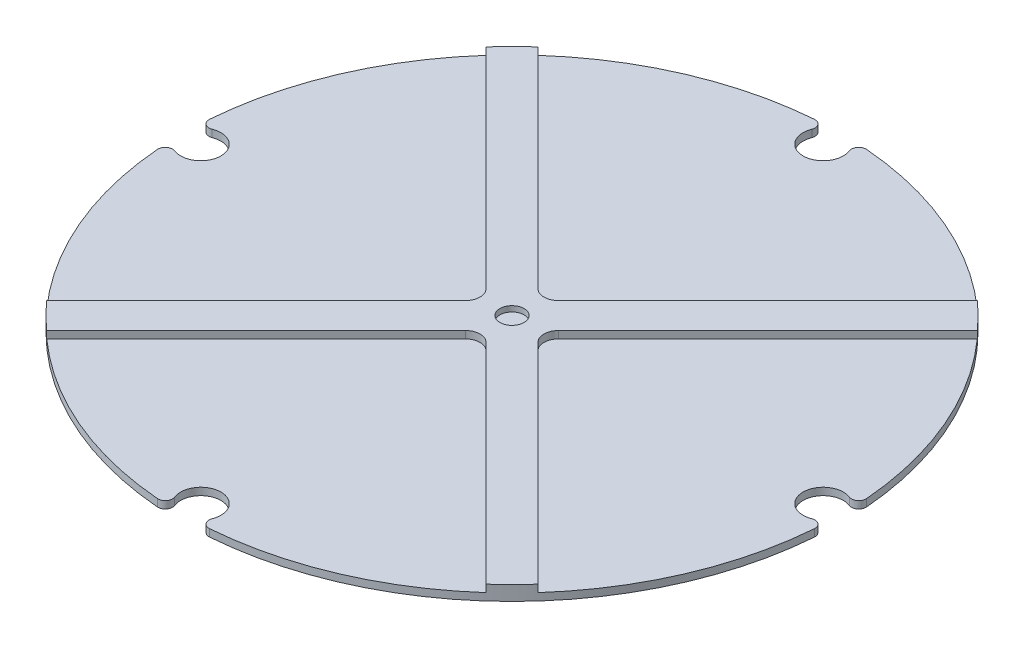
SolidWorks part; units mm, degrees
ref_plane "Front Plane" through (0, 0, 0) normal (0, 0, 1) x (1, 0, 0)
ref_plane "Top Plane" through (0, 0, 0) normal (0, 1, 0) x (1, 0, 0)
ref_plane "Right Plane" through (0, 0, 0) normal (1, 0, 0) x (0, 0, -1)
sketch "Sketch1" plane through (0, 0, 0) normal (0, 1, 0) x (1, 0, 0)
  line L0 (0, 0) -> (0, 45) construction
  circle A0 centre (0, 0) radius 45
  dimension "D1" = 90
extrude "Boss-Extrude1" add sketch "Sketch1" along normal blind 1
sketch "Sketch2" plane through (0, 1, 0) normal (0, 1, 0) x (1, 0, 0)
  line L0 (0, 0) -> (0, 45) construction
  circle A0 centre (0, 0) radius 45 construction
  circle A1 centre (0, 42.5) radius 2.75
  circle A2 centre (42.5, 0) radius 2.75
  circle A3 centre (0, -42.5) radius 2.75
  circle A4 centre (-42.5, 0) radius 2.75
  point P16 (0, 0)
  dimension "D1" = 5.5
  dimension "D2" = 42.5
  dimension "D3" = 4
extrude "Cut-Extrude4" cut sketch "Sketch2" against normal blind 1
fillet "Fillet1" radius 1 8 edges at (-44.9846, 0.5, 1.1788) (-44.9846, 0.5, -1.1788) (1.1788, 0.5, 44.9846) (-1.1788, 0.5, 44.9846) (44.9846, 0.5, -1.1788) (44.9846, 0.5, 1.1788) (-1.1788, 0.5, -44.9846) (1.1788, 0.5, -44.9846)
sketch "Sketch3" plane through (0, 1, 0) normal (0, 1, 0) x (1, 0, 0)
  line L0 (0, 0) -> (0, -39.75) construction
  line L1 (0, 0) -> (31.8198, -31.8198) construction
  line L2 (0, 0) -> (31.8198, 31.8198) construction
  line L3 (-30.0029, 33.5384) -> (-1.4142, 4.9497)
  line L4 (-33.5384, 30.0029) -> (-4.9497, 1.4142)
  line L5 (33.5384, 30.0029) -> (4.9497, 1.4142)
  line L6 (30.0029, 33.5384) -> (1.4142, 4.9497)
  line L7 (4.9497, -1.4142) -> (33.5384, -30.0029)
  line L8 (1.4142, -4.9497) -> (30.0029, -33.5384)
  line L9 (-1.4142, -4.9497) -> (-30.0029, -33.5384)
  line L10 (-4.9497, -1.4142) -> (-33.5384, -30.0029)
  arc A0 (2.5625, -43.4981) -> (-2.5625, -43.4981) centre (0, -42.5) ccw construction
  arc A1 (3.5737, -44.8579) -> (44.8579, -3.5737) centre (0, 0) ccw construction
  arc A2 (44.8579, 3.5737) -> (3.5737, 44.8579) centre (0, 0) ccw construction
  arc A3 (33.5384, 30.0029) -> (30.0029, 33.5384) centre (0, 0) ccw
  arc A4 (30.0029, -33.5384) -> (33.5384, -30.0029) centre (0, 0) ccw
  arc A5 (-44.8579, -3.5737) -> (-3.5737, -44.8579) centre (0, 0) ccw construction
  arc A6 (-33.5384, -30.0029) -> (-30.0029, -33.5384) centre (0, 0) ccw
  arc A7 (-3.5737, 44.8579) -> (-44.8579, 3.5737) centre (0, 0) ccw construction
  arc A8 (-30.0029, 33.5384) -> (-33.5384, 30.0029) centre (0, 0) ccw
  arc A9 (1.4142, -4.9497) -> (-1.4142, -4.9497) centre (0, -6.364) ccw
  arc A10 (-4.9497, 1.4142) -> (-4.9497, -1.4142) centre (-6.364, 0) cw
  arc A11 (-1.4142, 4.9497) -> (1.4142, 4.9497) centre (0, 6.364) ccw
  arc A12 (4.9497, -1.4142) -> (4.9497, 1.4142) centre (6.364, 0) cw
  point P19 (-1.7678, -1.7678)
  point P20 (1.7678, 1.7678)
  point P32 (0, -3.5355)
  point P35 (-3.5355, 0)
  dimension "D3" = 2
  dimension "D1" = 5
  dimension "D2" = 2.5
extrude "Boss-Extrude2" add sketch "Sketch3" along normal blind 1
sketch "Sketch4" plane through (0, 2, 0) normal (0, 1, 0) x (1, 0, 0)
  circle A0 centre (0, 0) radius 1.65
  dimension "D1" = 3.3
extrude "Cut-Extrude5" cut sketch "Sketch4" against normal blind 0.75
